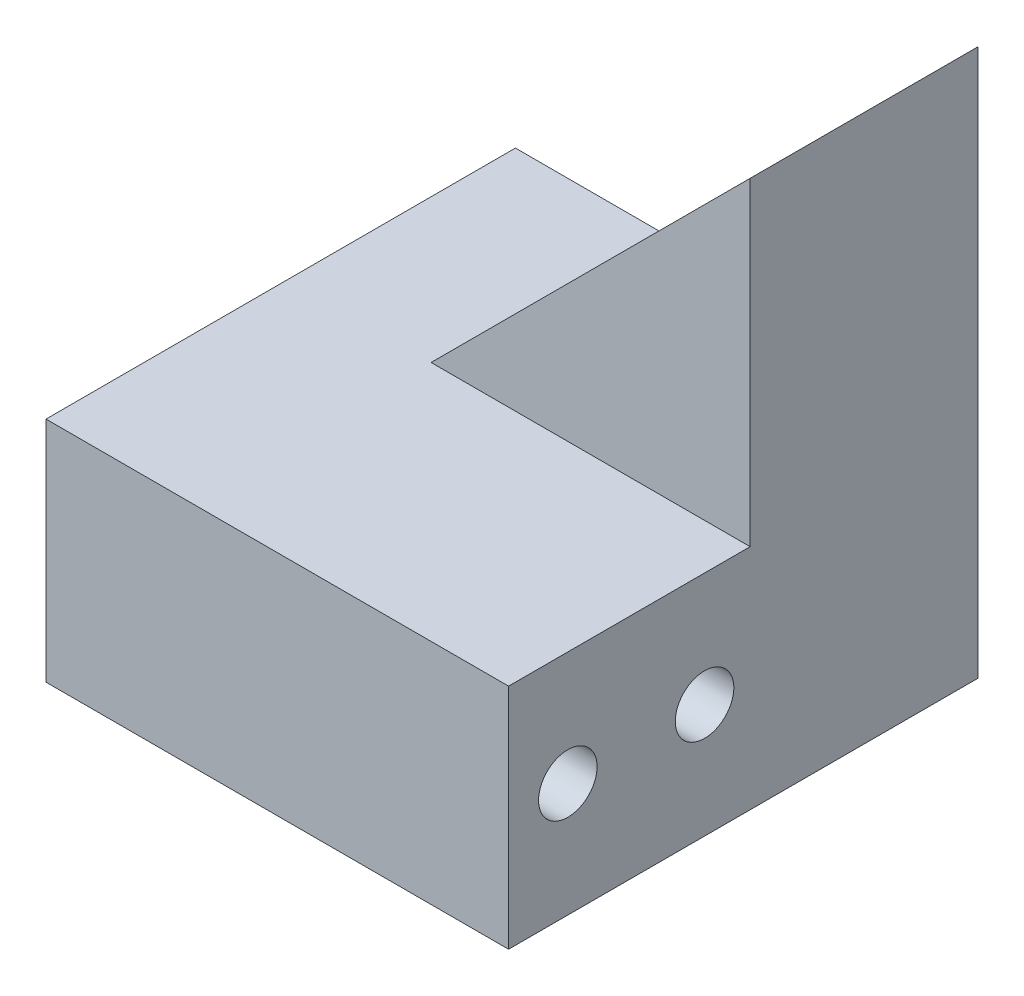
SolidWorks part; units mm, degrees
ref_plane "Front Plane" through (0, 0, 0) normal (0, 0, 1) x (1, 0, 0)
ref_plane "Top Plane" through (0, 0, 0) normal (0, 1, 0) x (1, 0, 0)
ref_plane "Right Plane" through (0, 0, 0) normal (1, 0, 0) x (0, 0, -1)
sketch "Sketch1" plane through (0, 0, 0) normal (0, 1, 0) x (1, 0, 0)
  line L1 (-30.4548, 16.5538) -> (-12.6748, 16.5538)
  line L2 (-30.4548, 16.5538) -> (-30.4548, -12.1482)
  line L3 (-30.4548, -12.1482) -> (-12.6748, -12.1482)
  line L4 (-12.6748, 16.5538) -> (-12.6748, -12.1482)
extrude "Boss-Extrude1" add sketch "Sketch1" along normal blind 30.48
sketch "Sketch2" plane through (-30.4548, 0, 0) normal (-1, 0, 0) x (0, 0, 1)
  line L0 (12.1482, 30.48) -> (12.1482, 0) construction
  line L1 (-16.5538, 0) -> (12.1482, 0)
  line L2 (-16.5538, 0) -> (-16.5538, 12.7)
  line L3 (-16.5538, 12.7) -> (12.1482, 12.7)
  line L4 (12.1482, 0) -> (12.1482, 12.7)
  line L5 (-16.5538, 30.48) -> (12.1482, 30.48) construction
  line L6 (-16.5538, 12.7) -> (-3.8538, 12.7)
  line L7 (-16.5538, 12.7) -> (-16.5538, 30.48)
  line L8 (-16.5538, 30.48) -> (-3.8538, 30.48)
  line L9 (-3.8538, 12.7) -> (-3.8538, 30.48)
extrude "Cut-Extrude1" cut sketch "Sketch2" against normal blind 30.48 contours L9 L3 M2 M3
sketch "Sketch3" plane through (0, 0, -3.8538) normal (0, 0, 1) x (1, 0, 0)
  line L0 (-30.4548, 12.7) -> (59.3477, 102.5026)
  line L1 (-12.6748, 12.7) -> (-30.4548, 12.7)
  line L2 (-30.4548, 12.7) -> (-30.4548, 30.48)
  line L4 (-30.4548, 12.7) -> (-30.4548, 30.48)
  arc A0 (96.5452, 12.7) -> (59.3477, 102.5026) centre (-30.4548, 12.7) ccw
  dimension "D1" = 45
  dimension "D2" = 127
extrude "Cut-Extrude2" cut sketch "Sketch3" against normal blind 30.48 contours L0 M6 M5
sketch "Sketch7" plane through (-30.4548, 0, 0) normal (-1, 0, 0) x (0, 0, 1)
  line L0 (-16.5538, 0) -> (12.1482, 0) construction
  line L1 (12.1482, 12.7) -> (9.6082, 12.7)
  line L2 (12.1482, 12.7) -> (12.1482, 0)
  line L3 (12.1482, 0) -> (9.6082, 0)
  line L4 (9.6082, 12.7) -> (9.6082, 0)
extrude "Cut-Extrude3" cut sketch "Sketch7" against normal through all
sketch "Sketch8" plane through (-30.4548, 0, 0) normal (-1, 0, 0) x (0, 0, 1)
  line L1 (-16.5538, 12.7) -> (9.6082, 12.7)
  line L2 (-16.5538, 12.7) -> (-16.5538, 0)
  line L3 (-16.5538, 0) -> (9.6082, 0)
  line L4 (9.6082, 12.7) -> (9.6082, 0)
extrude "Boss-Extrude2" add sketch "Sketch8" along normal blind 8
hole_wizard "#30 (0.1285) Diameter Hole1" positions "Sketch11" profile "Sketch12" hole size "#30" standard "ANSI Inch"
sketch "Sketch11" plane through (-38.4548, 0, 0) normal (-1, 0, 0) x (0, 0, 1)
  line L0 (-16.5538, 12.7) -> (-16.5538, 0) construction
  line L1 (-16.5538, 0) -> (9.6082, 0) construction
  point P0 (-1.3138, 6.35)
  point P2 (6.3062, 6.35)
  dimension "D1" = 7.62
  dimension "D2" = 15.24
  dimension "D3" = 6.35
sketch "Sketch12" plane through (-38.4548, 6.35, -1.3138) normal (0, 1, 0) x (0, 0, 1)
  line L0 (0, 0) -> (0, 51.7806)
  line L1 (0, 51.7806) -> (1.6319, 50.8)
  line L2 (1.6319, 50.8) -> (1.6319, 0)
  line L5 (1.6319, 0) -> (0, 0)
  line L10 (0, 51.7806) -> (-1.632, 50.8) construction
  line L11 (0, -6.35) -> (0, 107.95) construction
  dimension "Hole Dia." = 3.2639
  dimension "Hole Depth" = 50.8
  dimension "Drill Angle" = 118
